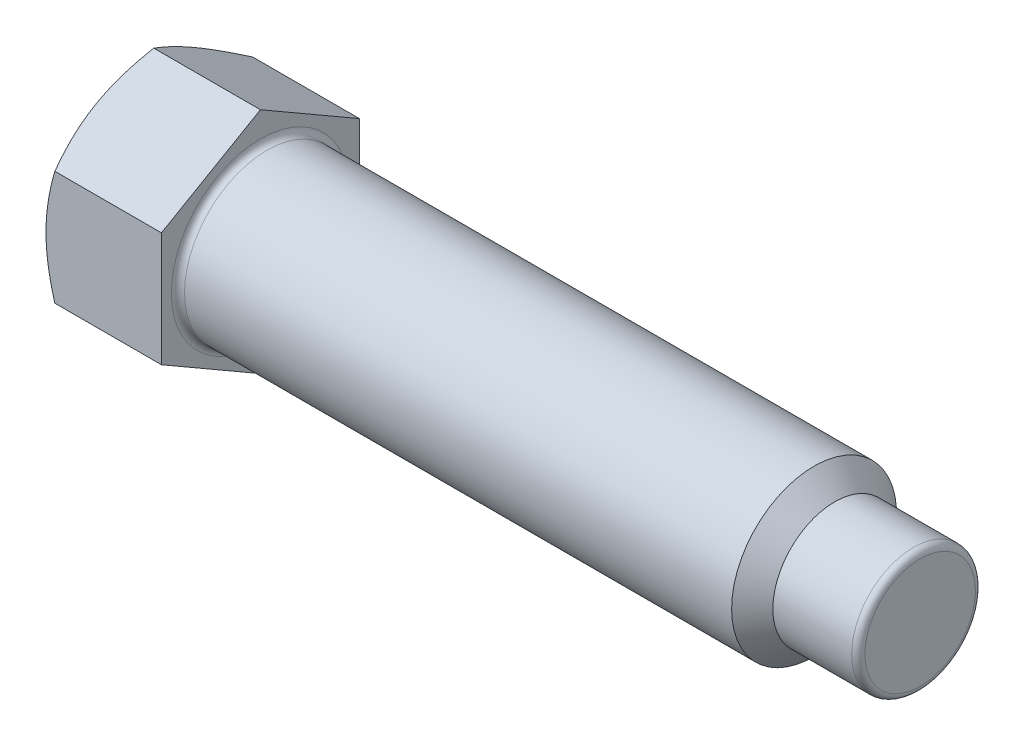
SolidWorks part; units mm, degrees
extrude "BaseHead" add sketch "HexSke" along normal blind 14
sketch "HexSke" plane through (0, 0, 0) normal (1, 0, 0) x (0, 0, -1)
  line L0 (12, 6.9282) -> (12, -6.9282)
  line L1 (-12, 6.9282) -> (-12, -6.9282)
  line L2 (12, -6.9282) -> (0, -13.8564)
  line L3 (0, -13.8564) -> (-12, -6.9282)
  line L4 (12, 6.9282) -> (0, 13.8564)
  line L5 (0, 13.8564) -> (-12, 6.9282)
ref_plane "Plane1" through (0, 0, 0) normal (0, 0, 1) x (1, 0, 0)
ref_plane "Plane2" through (0, 0, 0) normal (0, 1, 0) x (1, 0, 0)
ref_plane "Plane3" through (0, 0, 0) normal (1, 0, 0) x (0, 0, -1)
other "Configuration Table"
sketch "BodySke" plane through (0, 0, 0) normal (0, 0, 1) x (1, 0, 0)
  line L0 (0, 6.9282) -> (0, -6.9282) construction
  line L1 (0, 0) -> (94, 0)
  line L2 (0, 0) -> (0, 10)
  line L3 (0, 10) -> (81.14, 10)
  line L4 (94, 0) -> (94, 7.5)
  line L5 (14, 13.8564) -> (14, 6.9282) construction
  line L6 (83.64, 7.5) -> (81.14, 10)
  line L7 (0, 0) -> (114.3068, 0) construction
  line L8 (128.3703, 17) -> (63.1669, 17) construction
  line L10 (16.5, 15.24) -> (16.5, -1.27) construction
  line L11 (94, 7.5) -> (83.64, 7.5)
  line L12 (14, 6.9282) -> (14, -6.9282) construction
revolve "BaseBody" add sketch "BodySke" angle 360 about L7
sketch "HeadChamSke" plane through (0, 0, 0) normal (0, 0, 1) x (1, 0, 0)
  line L0 (0, 12) -> (3.9585, 18.8564)
  line L1 (0, 13.8564) -> (0, 6.9282) construction
  line L2 (3.9585, 18.8564) -> (3.9585, 23.8564)
  line L3 (3.9585, 23.8564) -> (-10, 23.8564)
  line L4 (-10, 23.8564) -> (-10, 12)
  line L5 (-10, 12) -> (0, 12)
  line L6 (0, 0) -> (99.06, 0) construction
  line L7 (14, 13.8564) -> (0, 13.8564) construction
revolve "HeadChamfer" cut sketch "HeadChamSke" angle 360 about L6
fillet "HeadFillet" radius 0.8 1 edges at (14, 0, -10)
fillet "BaseBodyFillet" radius 0.8 1 edges at (94, 0, 7.5)
sketch "ThdSchSke" plane through (0, 0, 0) normal (0, 0, 1) x (1, 0, 0)
  line L0 (17.3, -8.5) -> (16.2497, -10)
  line L1 (17.3, -8.5) -> (18.3503, -10)
  line L2 (18.3503, -10) -> (18.3503, -12.5)
  line L3 (-3.175, 0) -> (5.1513, 0) construction
  line L5 (18.3503, -12.5) -> (16.2497, -12.5)
  line L6 (16.2497, -12.5) -> (16.2497, -10)
revolve "ThreadSchematic" [suppressed] cut sketch "ThdSchSke" angle 360 about L3
pattern_linear "ThdSchPat" [suppressed]
equation "\"D3@HexSke\" = \"Width_flats@HexSke\" / 2"
equation "\"D4@HexSke\" = \"D3@HexSke\""
equation "\"D5@HexSke\" = \"D4@HexSke\""
equation "\"Thread_minor@ThreadCosmetic\" = \"Minor_dia@BodySke\""
equation "\"D1@HeadChamSke\" = \"Width_flats@HexSke\" / 2"
equation "\"Thread_length@ThreadCosmetic\" = \"Length@BodySke\" - \"Dog_Lg@BodySke\" - \"Advance@BodySke\""
equation "\"Thread_minor@ThdSchSke\" = \"Minor_dia@BodySke\""
equation "\"Diameter@ThdSchSke\" = \"Diameter@BodySke\""
equation "\"Overcut@ThdSchSke\" = \"Diameter@BodySke\" * 1.25"
equation "\"Start@ThdSchSke\" = \"Fillet_Radius@HeadFillet\" + \"Advance@BodySke\" + \"Head_ht@BaseHead\""
equation "\"Num_threads@ThdSchPat\" = int( \"Thread_length@ThreadCosmetic\" / \"Advance@BodySke\" + 0.999 )  + 1"
equation "\"Advance@ThdSchPat\" = \"Thread_length@ThreadCosmetic\" /  (\"Num_threads@ThdSchPat\" - 1) 'relax it"
equation "\"Num_threads@ThdSchPat\" = \"Num_threads@ThdSchPat\" - sgn( \"Num_threads@ThdSchPat\" - 1) '---chamfered tips only---"
equation "\"Fillet_Radius@BaseBodyFillet\" = \"Fillet_Radius@HeadFillet\""
